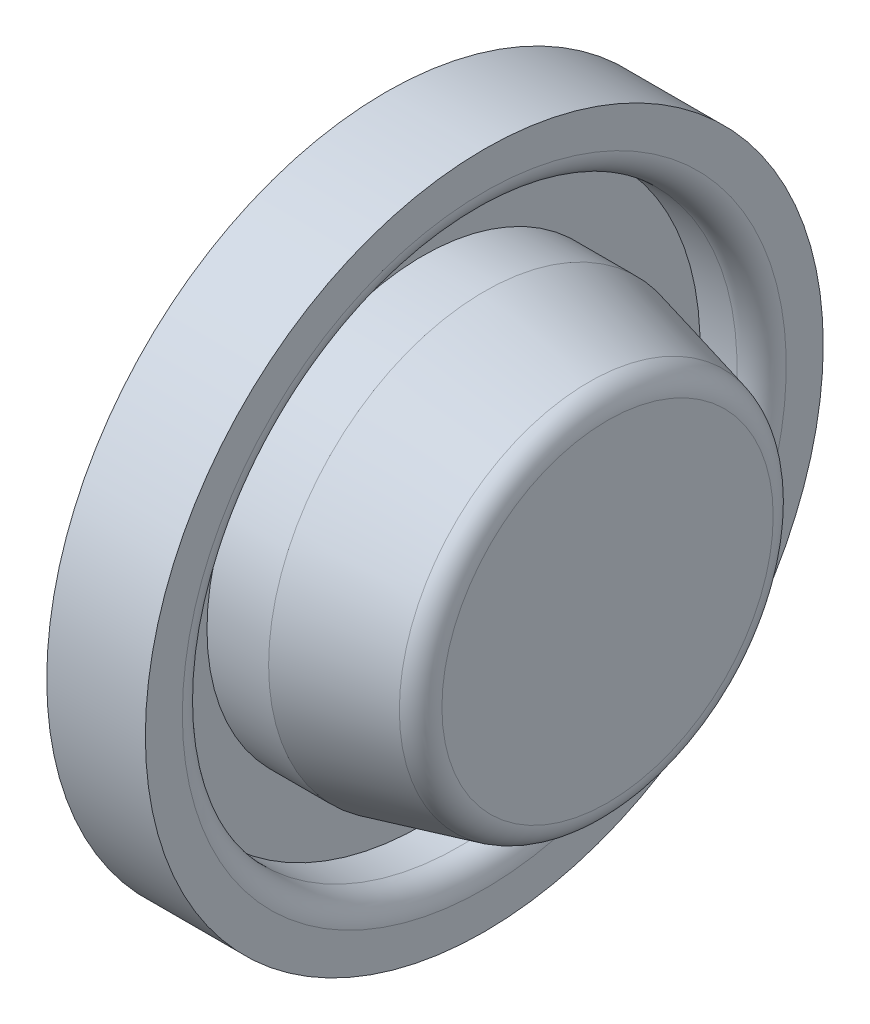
SolidWorks part; units mm, degrees
ref_plane "Plan de face" through (0, 0, 0) normal (0, 0, 1) x (1, 0, 0)
ref_plane "Plan de dessus" through (0, 0, 0) normal (0, 1, 0) x (1, 0, 0)
ref_plane "Plan de droite" through (0, 0, 0) normal (1, 0, 0) x (0, 0, -1)
sketch "Esquisse1" plane through (0, 0, 0) normal (0, 0, 1) x (1, 0, 0)
  line L0 (0, 0) -> (18, 0)
  line L1 (18, 0) -> (18, 15)
  line L2 (8, 17.5) -> (18, 15)
  line L3 (8, 17.5) -> (3, 17.5)
  line L4 (3, 17.5) -> (3, 22.5)
  line L5 (3, 22.5) -> (8, 22.5)
  line L6 (8, 22.5) -> (8, 27.5)
  line L7 (8, 27.5) -> (0, 27.5)
  line L8 (0, 27.5) -> (0, 0)
  dimension "D1" = 18
  dimension "D2" = 15
  dimension "D3" = 8
  dimension "D4" = 27.5
  dimension "D5" = 5
  dimension "D6" = 5
  dimension "D7" = 5
  dimension "D8" = 5
revolve "Révolution1" add sketch "Esquisse1" angle 360 about L0
fillet "Congé1" radius 2 1 edges at (18, 0, 15)
fillet "Congé2" radius 2 1 edges at (8, 0, 22.5)
sketch "Esquisse2" plane through (0, 0, 0) normal (-1, 0, 0) x (0, 0, 1)
  circle A0 centre (0, 0) radius 10
  dimension "D1" = 20
extrude "Enlèv. mat.-Extru.1" cut sketch "Esquisse2" against normal blind 3
sketch "Esquisse5" plane through (3, 0, 0) normal (-1, 0, 0) x (0, 0, 1)
  circle A0 centre (0, 0) radius 5.5
  dimension "D1" = 11
extrude "Enlèv. mat.-Extru.2" cut sketch "Esquisse5" against normal blind 12
